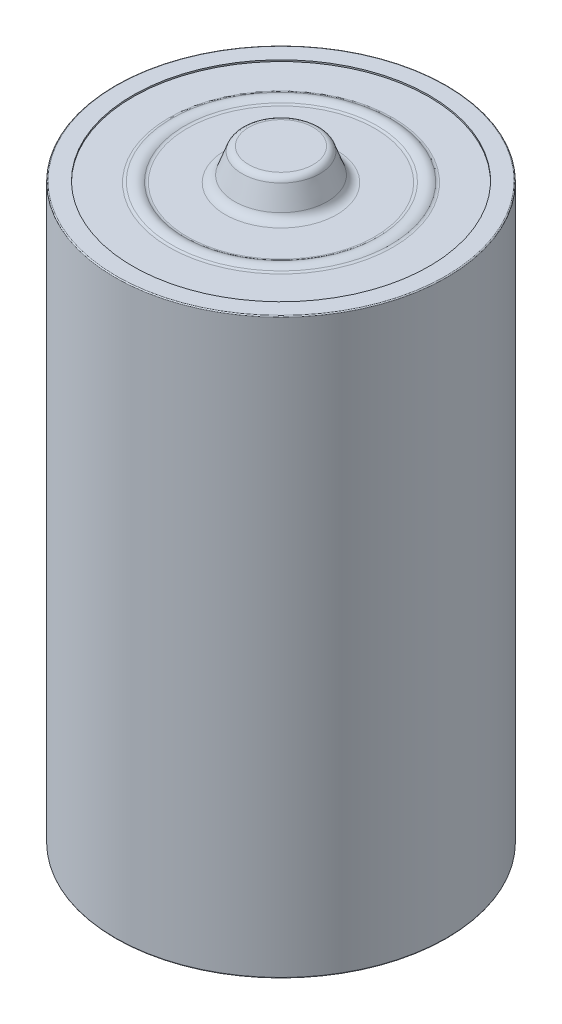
SolidWorks part; units mm, degrees
ref_plane "Front Plane" through (0, 0, 0) normal (0, 0, 1) x (1, 0, 0)
ref_plane "Top Plane" through (0, 0, 0) normal (0, 1, 0) x (1, 0, 0)
ref_plane "Right Plane" through (0, 0, 0) normal (1, 0, 0) x (0, 0, -1)
sketch "Sketch1" plane through (0, 0, 0) normal (1, 0, 0) x (0, 0, -1)
  line L0 (0, 0) -> (0, 60.3) construction
  line L1 (-16.5, 57.2) -> (-16.5, 0.3)
  line L2 (0, 1) -> (-1.3268, 1)
  line L3 (-1.5866, 0.85) -> (-1.8175, 0.45)
  line L4 (-2.2506, 0.2) -> (-2.7619, 0.2)
  line L5 (-16.4, 0.2) -> (-13.5, 0.2)
  line L6 (-13.5, 0.2) -> (-13.5, 0.25)
  line L7 (-13.5, 0.25) -> (-12.5, 0.25)
  line L8 (-12.5, 0.25) -> (-12.5, 0.35)
  line L9 (-12.5, 0.35) -> (-9.6948, 0.35)
  line L10 (-7.5552, 0.35) -> (-5.0333, 0.35)
  line L11 (-16.4, 57.3) -> (-14.75, 57.3)
  line L12 (-14.75, 57.3) -> (-14.75, 57.15)
  line L13 (-14.75, 57.15) -> (-11.1587, 57.15)
  line L14 (-9.3413, 57.15) -> (-5.5467, 57.15)
  line L15 (-4.607, 57.808) -> (-3.8676, 59.8394)
  line L16 (-3.2099, 60.3) -> (0, 60.3)
  line L17 (0, 1) -> (0, 60.3)
  arc A0 (-9.3801, 0.2386) -> (-7.8699, 0.2386) centre (-8.625, 1.1712) ccw
  arc A1 (-4.9675, 0.3457) -> (-2.7619, 0.2) centre (-2.7619, 16.9723) ccw
  arc A2 (-1.3268, 1) -> (-1.5866, 0.85) centre (-1.3268, 0.7) ccw
  arc A3 (-1.8175, 0.45) -> (-2.2506, 0.2) centre (-2.2506, 0.7) cw
  arc A4 (-5.0333, 0.35) -> (-4.9675, 0.3457) centre (-5.0333, -0.15) cw
  arc A5 (-9.6948, 0.35) -> (-9.3801, 0.2386) centre (-9.6948, -0.15) cw
  arc A6 (-7.5552, 0.35) -> (-7.8699, 0.2386) centre (-7.5552, -0.15) ccw
  arc A7 (-16.5, 0.3) -> (-16.4, 0.2) centre (-16.4, 0.3) ccw
  arc A8 (-9.6086, 57.2274) -> (-10.8914, 57.2274) centre (-10.25, 56.2133) ccw
  arc A9 (-3.8676, 59.8394) -> (-3.2099, 60.3) centre (-3.2099, 59.6) cw
  arc A10 (-5.5467, 57.15) -> (-4.607, 57.808) centre (-5.5467, 58.15) ccw
  arc A11 (-16.5, 57.2) -> (-16.4, 57.3) centre (-16.4, 57.2) cw
  arc A12 (-9.3413, 57.15) -> (-9.6086, 57.2274) centre (-9.3413, 57.65) cw
  arc A13 (-11.1587, 57.15) -> (-10.8914, 57.2274) centre (-11.1587, 57.65) ccw
  point P20 (-1.5, 1)
  point P23 (-1.9619, 0.2)
  point P26 (-5, 0.35)
  point P29 (-9.5, 0.35)
  point P32 (-7.75, 0.35)
  point P35 (-16.5, 0.2)
  point P45 (-3.7, 60.3)
  point P50 (-16.5, 57.3)
  point P53 (-9.5, 57.15)
  point P56 (-11, 57.15)
  dimension "D7" = 2.4
  dimension "D16" = 0.3
  dimension "D17" = 0.5
  dimension "D18" = 0.5
  dimension "D19" = 0.5
  dimension "D20" = 0.1
  dimension "D26" = 2.4
  dimension "D30" = 0.7
  dimension "D31" = 1
  dimension "D32" = 0.1
  dimension "D33" = 0.5
  dimension "D1" = 16.5
  dimension "D2" = 3
  dimension "D3" = 0.05
  dimension "D4" = 0.15
  dimension "D5" = 1
  dimension "D6" = 3
  dimension "D8" = 1.75
  dimension "D9" = 1
  dimension "D10" = 1.5
  dimension "D11" = 60
  dimension "D12" = 5
  dimension "D13" = 0.2
  dimension "D14" = 0.2
  dimension "D15" = 0.8
  dimension "D21" = 57
  dimension "D22" = 1.75
  dimension "D23" = 0.15
  dimension "D24" = 10.25
  dimension "D25" = 1.5
  dimension "D27" = 70
  dimension "D28" = 60.3
  dimension "D29" = 3.7
revolve "Revolve1" add sketch "Sketch1" angle 360 about L0
